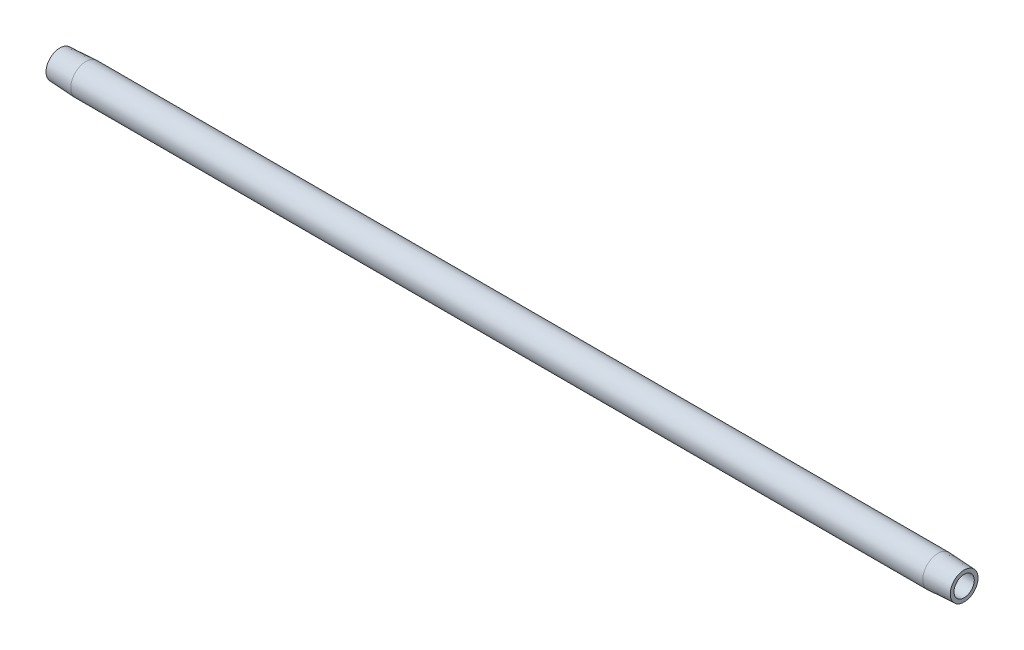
SolidWorks part; units mm, degrees
ref_plane "Front Plane" through (0, 0, 0) normal (0, 0, 1) x (1, 0, 0)
ref_plane "Top Plane" through (0, 0, 0) normal (0, 1, 0) x (1, 0, 0)
ref_plane "Right Plane" through (0, 0, 0) normal (1, 0, 0) x (0, 0, -1)
sketch "Sketch2" plane through (0, 0, 0) normal (0, 0, 1) x (1, 0, 0)
  line L0 (0.4761, 0) -> (50000.4761, 0) construction
  line L1 (0, -11.3625) -> (0, 49988.6375) construction
  line L7 (8.81, 5.1435) -> (0, 4.6818)
  line L8 (295.99, 5.1435) -> (8.81, 5.1435)
  line L9 (304.8, 4.6818) -> (295.99, 5.1435)
  line L10 (304.8, 3.4163) -> (304.8, 4.6818)
  line L11 (304.8, 3.4163) -> (0, 3.4163)
  line L12 (0, 4.6818) -> (0, 3.4163)
  dimension "D1" = 6.8326
  dimension "D2" = 10.287
  dimension "D3" = 3
  dimension "D4" = 3
  dimension "D5" = 8.81
  dimension "D6" = 8.81
  dimension "D7" = 304.8
revolve "Revolve1" add sketch "Sketch2" angle 360 about L0
